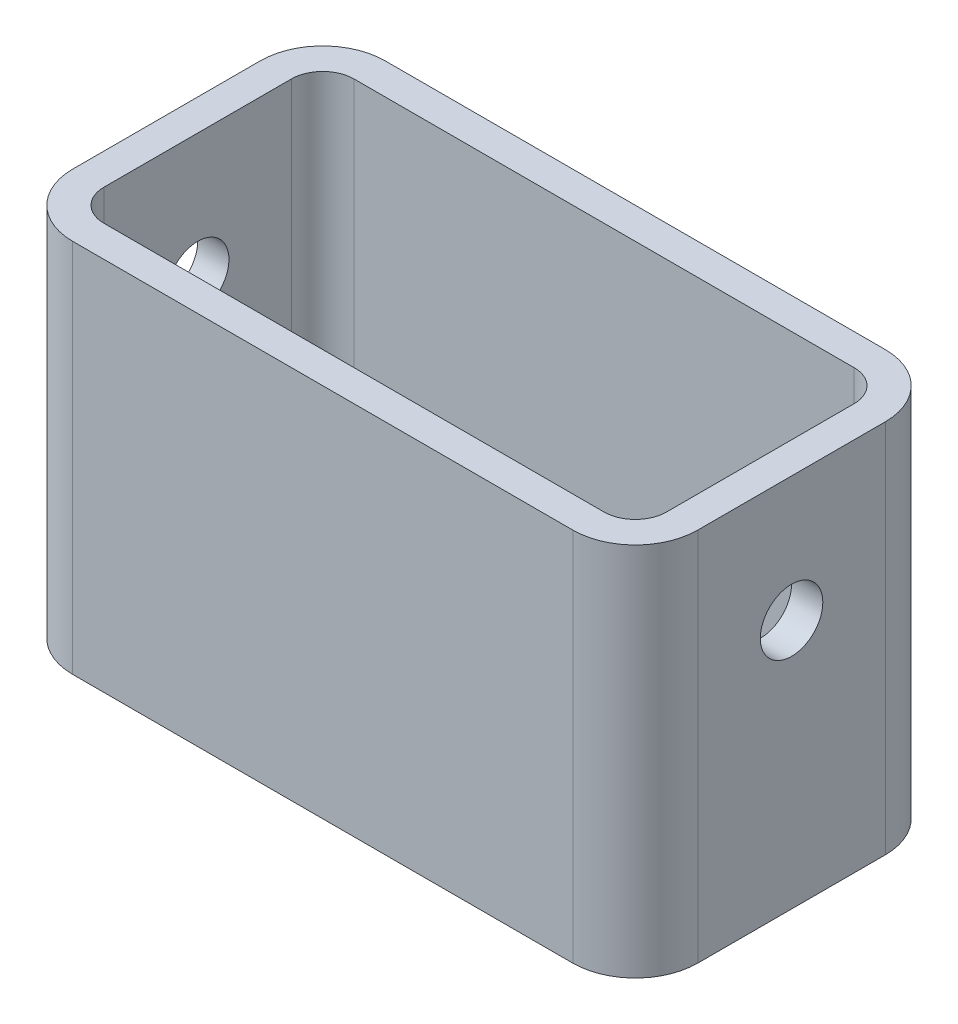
SolidWorks part; units mm, degrees
ref_plane "Front" through (0, 0, 0) normal (0, 0, 1) x (1, 0, 0)
ref_plane "Top" through (0, 0, 0) normal (0, 1, 0) x (1, 0, 0)
ref_plane "Right" through (0, 0, 0) normal (1, 0, 0) x (0, 0, -1)
sketch "Sketch1" plane through (0, 0, 0) normal (0, 0, 1) x (1, 0, 0)
  line L1 (0, 0) -> (100, 0)
  line L2 (0, 0) -> (0, 60)
  line L3 (0, 60) -> (100, 60)
  line L4 (100, 0) -> (100, 60)
  dimension "D1" = 100
  dimension "D2" = 60
extrude "Base-Extrude" add sketch "Sketch1" along normal blind 50
fillet "Fillet1" radius 10 4 edges at (100, 30, 50) (0, 30, 50) (100, 30, 0) (0, 30, 0)
shell "Shell1" thickness 5
sketch "Sketch3" plane through (100, 0, 0) normal (1, 0, 0) x (0, 0, -1)
  line L0 (-50, 0) -> (-50, 60) construction
  line L1 (-40, 0) -> (-10, 0) construction
  circle A0 centre (-25, 40) radius 5
  dimension "D1" = 10
  dimension "D2" = 25
  dimension "D3" = 40
extrude "Cut-Extrude1" cut sketch "Sketch3" against normal through all
